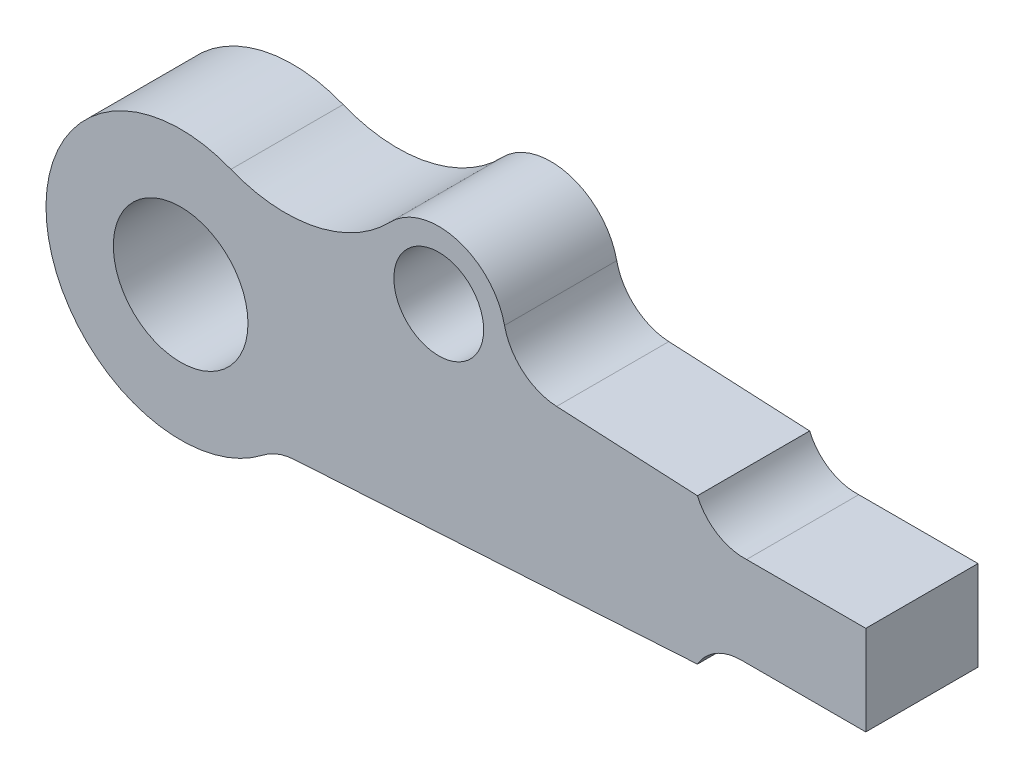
SolidWorks part; units mm, degrees
ref_plane "Front Plane" through (0, 0, 0) normal (0, 0, 1) x (1, 0, 0)
ref_plane "Top Plane" through (0, 0, 0) normal (0, 1, 0) x (1, 0, 0)
ref_plane "Right Plane" through (0, 0, 0) normal (1, 0, 0) x (0, 0, -1)
sketch "Sketch1" plane through (0, 0, 0) normal (0, 0, 1) x (1, 0, 0)
  line L0 (0, -101.6) -> (0, 101.6) construction
  line L1 (1550.7677, -101.6) -> (1550.7677, 101.6)
  line L2 (1550.7677, -101.6) -> (1269.0028, -101.6)
  line L3 (1169.7677, -159.1825) -> (1169.7677, 171.0175)
  line L4 (0, -228.6) -> (0, 228.6) construction
  line L5 (257.1283, -214.3166) -> (1169.7677, -159.1825)
  line L6 (1550.7677, 0) -> (1169.7677, 0) construction
  line L7 (1550.7677, 101.6) -> (1269.0028, 101.6)
  line L8 (850.9342, 186.7123) -> (1169.7677, 171.0175)
  circle A0 centre (0, 0) radius 152.4
  circle A1 centre (0, 0) radius 304.8
  circle A2 centre (584.2, 254) radius 101.6
  circle A3 centre (584.2, 254) radius 152.4
  arc A4 (113.7335, 282.7856) -> (474.5405, 359.8327) centre (236.9449, 589.1368) ccw
  arc A5 (257.1283, -214.3166) -> (186.9082, -240.7662) centre (264.7866, -341.0855) ccw
  arc A6 (1269.0028, -101.6) -> (1169.7677, -159.1825) centre (1269.0028, -215.9) ccw
  arc A7 (1169.7677, 171.0175) -> (1280.9031, 101.6) centre (1274.953, 215.745) ccw
  arc A8 (733.0972, 286.4866) -> (850.9342, 186.7123) centre (857.1782, 313.5587) ccw
  point P13 (0, 0)
  point P20 (0, 0)
  dimension "D1" = 609.6
  dimension "D2" = 304.8
  dimension "D3" = 203.2
  dimension "D6" = 304.8
  dimension "D7" = 660.4
  dimension "D8" = 203.2
  dimension "D13" = 254
  dimension "D14" = 228.6
  dimension "D9" = 228.6
  dimension "D11" = 254
  dimension "D17" = 114.3
  dimension "D19" = 114.3
  dimension "D4" = 254
  dimension "D5" = 584.2
  dimension "D10" = 330.2
  dimension "D12" = 457.2
  dimension "D15" = 912.6394
  dimension "D16" = 912.6394
  dimension "D18" = 318.8335
extrude "Boss-Extrude3" add sketch "Sketch1" against normal blind 254 contours A8 A3 A4 A1 A5 L5 L3 L8 | A7 L3 A6 L2 L1 L7 | A3 A2 | A1 A0
